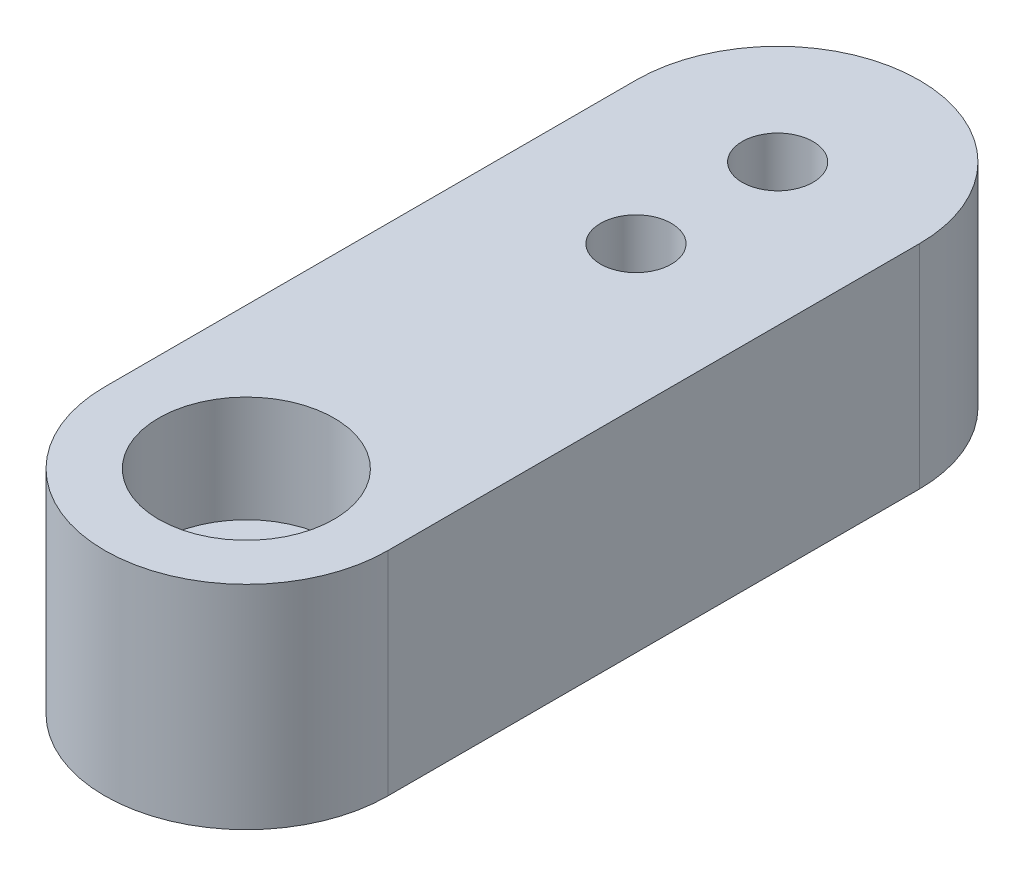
SolidWorks part; units mm, degrees
ref_plane "Front Plane" through (0, 0, 0) normal (0, 0, 1) x (1, 0, 0)
ref_plane "Top Plane" through (0, 0, 0) normal (0, 1, 0) x (1, 0, 0)
ref_plane "Right Plane" through (0, 0, 0) normal (1, 0, 0) x (0, 0, -1)
sketch "Sketch1" plane through (0, 0, 0) normal (0, 1, 0) x (1, 0, 0)
  line L0 (0, 0) -> (0, -15)
  line L1 (8, 0) -> (8, -15)
  circle A0 centre (4, 0) radius 1
  circle A1 centre (4, -4) radius 1
  arc A3 (8, 0) -> (0, 0) centre (4, 0) ccw
  arc A4 (0, -15) -> (8, -15) centre (4, -15) ccw
  circle A6 centre (4, -15) radius 1
  dimension "D3" = 2
  dimension "D6" = 2
  dimension "D4" = 2
  dimension "D2" = 4
  dimension "D1" = 15
  dimension "D7" = 4
extrude "Boss-Extrude2" add sketch "Sketch1" along normal blind 6
sketch "Sketch2" plane through (0, 6, 0) normal (0, 1, 0) x (1, 0, 0)
  circle A0 centre (4, -15) radius 2.477
  dimension "D1" = 4.9541
extrude "Cut-Extrude1" cut sketch "Sketch2" against normal blind 3
